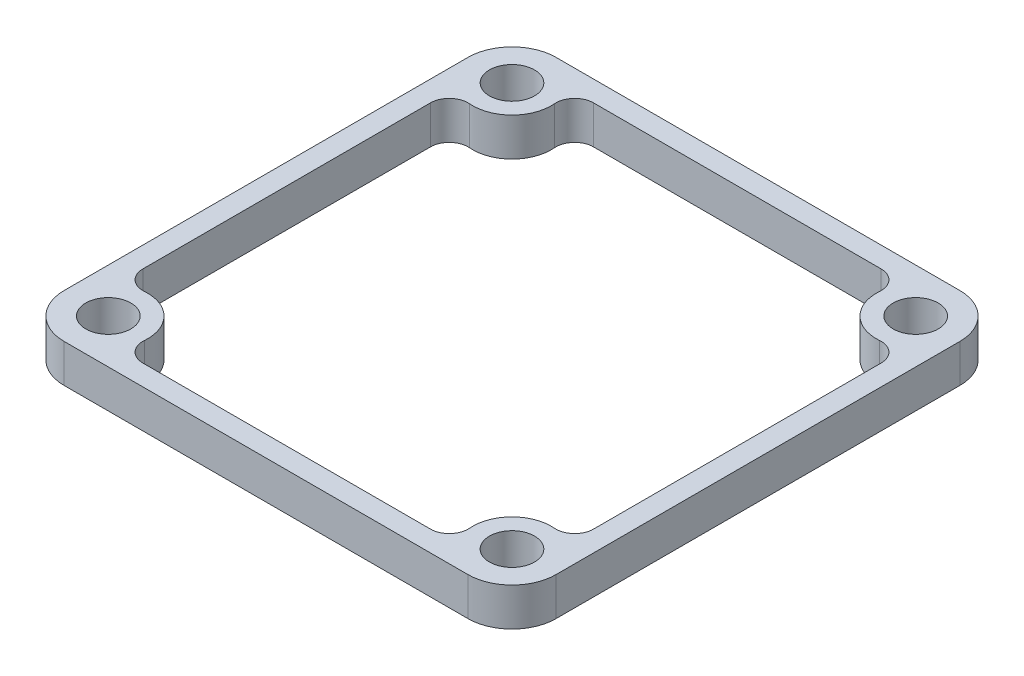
SolidWorks part; units mm, degrees
ref_plane "Front Plane" through (0, 0, 0) normal (0, 0, 1) x (1, 0, 0)
ref_plane "Top Plane" through (0, 0, 0) normal (0, 1, 0) x (1, 0, 0)
ref_plane "Right Plane" through (0, 0, 0) normal (1, 0, 0) x (0, 0, -1)
sketch "Sketch1" plane through (0, 0, 0) normal (0, 1, 0) x (1, 0, 0)
  circle A0 centre (0, 0) radius 1.2
  circle A1 centre (21.5, 0) radius 1.2
  circle A2 centre (21.5, 21.5) radius 1.2
  circle A3 centre (0, 21.5) radius 1.2
  circle A4 centre (0, 21.5) radius 2.1
  circle A5 centre (21.5, 21.5) radius 2.1
  circle A6 centre (21.5, 0) radius 2.1
  circle A7 centre (0, 0) radius 2.1
  dimension "D1" = 2.4
  dimension "D2" = 21.5
  dimension "D3" = 21.5
extrude "Boss-Extrude1" add sketch "Sketch1" along normal blind 2.032
sketch "Sketch5" plane through (0, 2.032, 0) normal (0, 1, 0) x (1, 0, 0)
  line L0 (-2.35, 21.5) -> (23.6, 21.5) construction
  line L2 (-1.25, 0) -> (-1.25, 21.5)
  line L4 (-2.35, 0) -> (-2.35, 21.5)
  line L5 (0, 22.75) -> (21.5, 22.75)
  line L7 (0, 23.85) -> (21.5, 23.85)
  line L10 (22.75, 21.5) -> (22.75, 0)
  line L12 (23.85, 21.5) -> (23.85, 0)
  line L13 (21.5, -1.25) -> (0, -1.25)
  line L15 (21.5, -2.35) -> (0, -2.35)
  line L17 (0, 23.3501) -> (0, -2.35) construction
  line L18 (21.5, 23.6) -> (21.5, -2.1) construction
  line L19 (23.6, 0) -> (-2.35, 0) construction
  arc A0 (0, -2.35) -> (-2.35, 0) centre (0, 0) cw
  arc A2 (0, -1.25) -> (-1.25, 0) centre (0, 0) cw
  circle A3 centre (0, 0) radius 1.25 construction
  circle A4 centre (0, 21.5) radius 1.25 construction
  circle A5 centre (21.5, 21.5) radius 1.25 construction
  circle A6 centre (21.5, 0) radius 1.25 construction
  arc A7 (21.5, 22.75) -> (22.75, 21.5) centre (21.5, 21.5) cw
  arc A8 (-2.35, 21.5) -> (0, 23.85) centre (0, 21.5) cw
  arc A9 (21.5, 23.85) -> (23.85, 21.5) centre (21.5, 21.5) cw
  arc A10 (23.85, 0) -> (21.5, -2.35) centre (21.5, 0) cw
  arc A11 (-1.25, 21.5) -> (0, 22.75) centre (0, 21.5) cw
  arc A14 (22.75, 0) -> (21.5, -1.25) centre (21.5, 0) cw
  dimension "D1" = 2.5
extrude "Boss-Extrude3" add sketch "Sketch5" against normal blind 2.032
fillet "Fillet1" radius 1 1 edges at (19.8125, 1.016, -22.75)
fillet "Fillet2" radius 1 1 edges at (1.6875, 1.016, -22.75)
fillet "Fillet3" radius 1 1 edges at (-1.25, 1.016, -19.8125)
fillet "Fillet4" radius 1 1 edges at (-1.25, 1.016, -1.6875)
fillet "Fillet5" radius 1 1 edges at (1.6875, 1.016, 1.25)
fillet "Fillet6" radius 1 1 edges at (19.8125, 1.016, 1.25)
fillet "Fillet7" radius 1 1 edges at (22.75, 1.016, -1.6875)
fillet "Fillet8" radius 1 1 edges at (22.75, 1.016, -19.8125)
